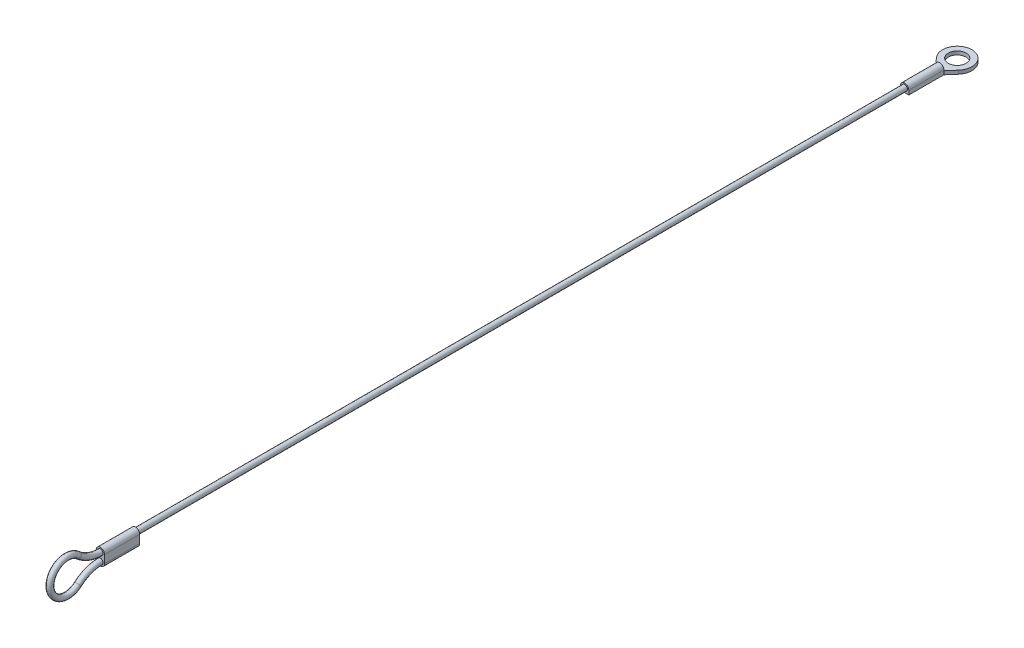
SolidWorks part; units mm, degrees
ref_plane "Front Plane" through (0, 0, 0) normal (0, 0, 1) x (1, 0, 0)
ref_plane "Top Plane" through (0, 0, 0) normal (0, 1, 0) x (1, 0, 0)
ref_plane "Right Plane" through (0, 0, 0) normal (1, 0, 0) x (0, 0, -1)
sketch "Sketch1" plane through (0, 0, 0) normal (1, 0, 0) x (0, 0, -1)
  line L2 (-229.4, 0) -> (0, 0)
  arc A0 (-229.4, 0) -> (-235.8, 2.4446) centre (-229.4, 9.6) cw
  arc A1 (-235.8, 2.4446) -> (-235.8, -4.7108) centre (-239, -1.1331) ccw
  arc A2 (-235.8, -4.7108) -> (-229.4, -2.2663) centre (-229.4, -11.8663) cw
  dimension "D1" = 4.8
  dimension "D4" = 9.6
  dimension "D2" = 239
  dimension "D3" = 9.6
sketch "Sketch2" plane through (0, 0, 0) normal (0, 0, 1) x (1, 0, 0)
  circle A0 centre (0, 0) radius 0.795
  dimension "D1" = 1.59
sweep "Sweep1" add profiles "Sketch2" path "Sketch1"
sketch "Sketch3" plane through (0, 0, 229.4) normal (0, 0, -1) x (-1, 0, 0)
  line L0 (0, 0) -> (0, -2.2663) construction
  line L1 (1.195, 0) -> (1.195, -2.2663)
  line L2 (-1.195, 0) -> (-1.195, -2.2663)
  line L3 (-0.795, -2.2663) -> (0.795, -2.2663) construction
  arc A0 (1.195, 0) -> (-1.195, 0) centre (0, 0) ccw
  arc A1 (-1.195, -2.2663) -> (1.195, -2.2663) centre (0, -2.2663) ccw
  point P3 (0, -1.1331)
  dimension "D1" = 2.39
extrude "Boss-Extrude1" add sketch "Sketch3" along normal blind 10
sketch "Sketch4" plane through (0, 0, 0) normal (0, 0, -1) x (-1, 0, 0)
  line L0 (-1.195, 0) -> (-1.195, -1.195)
  line L1 (-1.195, -1.195) -> (0, -1.195)
  line L2 (0, -1.195) -> (1.195, -1.195)
  line L3 (1.195, -1.195) -> (1.195, 0)
  arc A0 (1.195, 0) -> (-1.195, 0) centre (0, 0) ccw
  dimension "D1" = 2.39
extrude "Boss-Extrude2" add sketch "Sketch4" along normal blind 10
sketch "Sketch5" plane through (0, -1.195, 0) normal (0, -1, 0) x (1, 0, 0)
  line L0 (-1.195, -10) -> (1.195, -10)
  line L1 (1.195, -10) -> (3.155, -12.2428)
  line L2 (-3.155, -12.2428) -> (-1.195, -10)
  arc A0 (3.155, -12.2428) -> (-3.155, -12.2428) centre (0, -15) cw
  circle A1 centre (0, -15) radius 2.54
  point P8 (-4.19, -15)
  point P9 (4.19, -15)
  dimension "D1" = 5.08
  dimension "D2" = 8.38
  dimension "D3" = 15
extrude "Boss-Extrude3" add sketch "Sketch5" against normal blind 1.01
